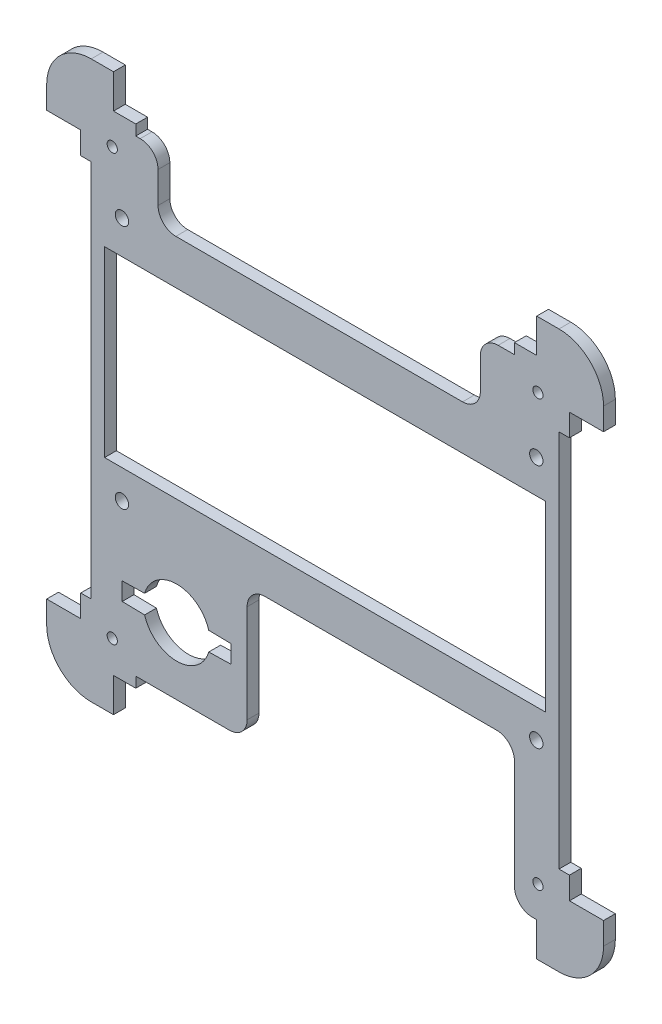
SolidWorks part; units mm, degrees
ref_plane "Alzado" through (0, 0, 0) normal (0, 0, 1) x (1, 0, 0)
ref_plane "Planta" through (0, 0, 0) normal (0, 1, 0) x (1, 0, 0)
ref_plane "Vista lateral" through (0, 0, 0) normal (1, 0, 0) x (0, 0, -1)
sketch "Croquis1" plane through (0, 0, 0) normal (0, 0, 1) x (1, 0, 0)
  line L1 (110, 125) -> (110, 117.35)
  line L2 (110, 117.35) -> (105, 117.35)
  line L6 (117.35, 105) -> (117.35, 110)
  line L7 (117.35, 110) -> (120, 110)
  line L9 (62.5, 117.35) -> (62.5, 135.4759) construction
  line L11 (110, 125) -> (115, 125)
  line L12 (125, 115) -> (125, 110)
  line L13 (125.0909, 105.0002) -> (120.0909, 105.0002) construction
  line L14 (85, 7.65) -> (40, 7.65) construction
  line L15 (117.35, 85) -> (117.35, 40) construction
  line L16 (7.65, 40) -> (7.65, 85) construction
  line L17 (40, 117.35) -> (85, 117.35) construction
  line L18 (85, 7.65) -> (40, 7.65) construction
  line L19 (117.35, 85) -> (117.35, 40) construction
  line L20 (7.65, 40) -> (7.65, 85) construction
  line L21 (40, 117.35) -> (85, 117.35) construction
  line L22 (120, 110) -> (125, 110)
  line L26 (117, 62.5) -> (135.1491, 62.5) construction
  line L27 (105, 117.35) -> (105, 105)
  line L28 (105, 105) -> (117.35, 105)
  line L29 (20, 105) -> (7.65, 105)
  line L30 (20, 117.35) -> (20, 105)
  line L32 (0, 115) -> (0, 110)
  line L33 (15, 125) -> (10, 125)
  line L36 (7.65, 110) -> (0, 110)
  line L37 (7.65, 105) -> (7.65, 110)
  line L38 (15, 117.35) -> (20, 117.35)
  line L39 (15, 125) -> (15, 117.35)
  line L42 (15, 0) -> (15, 7.65)
  line L43 (15, 7.65) -> (20, 7.65)
  line L44 (7.65, 20) -> (7.65, 15)
  line L45 (7.65, 15) -> (0, 15)
  line L48 (15, 0) -> (10, 0)
  line L49 (0, 10) -> (0, 15)
  line L51 (20, 7.65) -> (20, 20)
  line L52 (20, 20) -> (7.65, 20)
  line L53 (105, 20) -> (117.35, 20)
  line L54 (105, 7.65) -> (105, 20)
  line L56 (125, 10) -> (125, 15)
  line L57 (110, 0) -> (115, 0)
  line L60 (117.35, 15) -> (125, 15)
  line L61 (117.35, 20) -> (117.35, 15)
  line L62 (110, 7.65) -> (105, 7.65)
  line L63 (110, 0) -> (110, 7.65)
  line L65 (20, 105) -> (105, 20) construction
  line L67 (115, 10) -> (10, 10)
  line L68 (115, 10) -> (115, 115)
  line L69 (115, 115) -> (10, 115)
  line L70 (10, 10) -> (10, 115)
  line L71 (115, 10) -> (10, 115) construction
  line L72 (115, 115) -> (10, 10) construction
  arc A0 (125, 115) -> (115, 125) centre (115, 115) ccw
  arc A1 (0, 115) -> (10, 125) centre (10, 115) cw
  arc A2 (0, 10) -> (10, 0) centre (10, 10) ccw
  arc A3 (125, 10) -> (115, 0) centre (115, 10) cw
  point P22 (125, 125)
  point P53 (0, 125)
  point P68 (0, 0)
  point P83 (125, 0)
  point P84 (62.5, 62.5)
  dimension "D1" = 10
  dimension "D2" = 20
  dimension "D3" = 5
extrude "Saliente-Extruir1" add sketch "Croquis1" along normal up to surface (2.65 mm away)
sketch "Croquis2" plane through (0, 0, 2.65) normal (0, 0, 1) x (1, 0, 0)
  line L0 (62.5, 115) -> (62.5, 10) construction
  line L1 (105, 115) -> (20, 115) construction
  line L2 (105, 10) -> (20, 10) construction
  line L3 (10, 62.5) -> (115, 62.5) construction
  line L4 (10, 20) -> (10, 105) construction
  line L5 (115, 20) -> (115, 105) construction
  line L6 (105, 115) -> (20, 115) construction
  line L7 (112, 49) -> (13, 49)
  line L8 (112, 49) -> (112, 90)
  line L9 (112, 90) -> (13, 90)
  line L10 (13, 49) -> (13, 90)
  line L11 (112, 49) -> (13, 90) construction
  line L12 (112, 90) -> (13, 49) construction
  point P12 (62.5, 69.5)
  dimension "D1" = 99
  dimension "D2" = 41
  dimension "D3" = 25
extrude "Cortar-Extruir1" cut sketch "Croquis2" against normal up to surface (2.65 mm away)
sketch "Croquis3" plane through (0, 0, 2.65) normal (0, 0, 1) x (1, 0, 0)
  line L1 (63.7088, 101) -> (104.7088, 101)
  line L2 (63.7088, 101) -> (63.7088, 96)
  line L3 (63.7088, 96) -> (104.7088, 96)
  line L4 (104.7088, 101) -> (104.7088, 96)
  line L5 (105, 115) -> (20, 115) construction
  dimension "D1" = 41
  dimension "D2" = 5
  dimension "D3" = 14
extrude "Cortar-Extruir2" [suppressed] cut sketch "Croquis3" against normal blind 3
sketch "Croquis4" plane through (0, 0, 2.65) normal (0, 0, 1) x (1, 0, 0)
  line L0 (62.5, 115) -> (62.5, 103.7741) construction
  line L1 (105, 115) -> (20, 115) construction
  line L2 (10, 62.5) -> (-15.294, 62.5) construction
  line L3 (10, 20) -> (10, 105) construction
  circle A0 centre (14.7211, 110.2789) radius 1.15 construction
  circle A1 centre (14.7211, 110.2789) radius 1.15
  circle A2 centre (110.2789, 110.2789) radius 1.15
  circle A3 centre (110.2789, 14.7211) radius 1.15
  circle A4 centre (14.7211, 14.7211) radius 1.15
extrude "Cortar-Extruir4" cut sketch "Croquis4" against normal up to surface (2.65 mm away)
sketch "Croquis5" plane through (0, 0, 0) normal (0, 0, -1) x (-1, 0, 0)
  circle A2 centre (-55.5, 34.5) radius 1.5
  circle A3 centre (-99.5, 20.5) radius 1.5
extrude "Cortar-Extruir5" cut sketch "Croquis5" against normal up to surface (2.65 mm away)
sketch "Croquis6" plane through (0, 0, 0) normal (0, 0, -1) x (-1, 0, 0)
  line L0 (-16.9, 97.5) -> (-109.9, 97.5) construction
  line L1 (-109.9, 97.5) -> (-109.9, 42.5) construction
  line L2 (-109.9, 42.5) -> (-16.9, 42.5) construction
  circle A0 centre (-16.9, 42.5) radius 1.5
  circle A1 centre (-109.9, 42.5) radius 1.5
  circle A2 centre (-109.9, 97.5) radius 1.5
  circle A3 centre (-16.9, 97.5) radius 1.5
  dimension "D1" = 3
extrude "Cortar-Extruir6" cut sketch "Croquis6" against normal up to surface (2.65 mm away)
sketch "Croquis7" plane through (0, 115, 0) normal (0, 1, 0) x (1, 0, 0)
  line L0 (78.35, -1.1785) -> (97.35, -1.1785) construction
  line L1 (78.35, -1.1785) -> (97.35, -1.1785) construction
  line L2 (105, -2.65) -> (20, -2.65) construction
  line L3 (78.35, -2.65) -> (97.35, -2.65)
  line L4 (78.35, -2.65) -> (78.35, 0)
  line L5 (78.35, 0) -> (97.35, 0)
  line L6 (97.35, -2.65) -> (97.35, 0)
  line L7 (105, 0) -> (20, 0) construction
extrude "Cortar-Extruir7" cut sketch "Croquis7" against normal blind 15
sketch "Croquis8" plane through (0, 0, 2.65) normal (0, 0, 1) x (1, 0, 0)
  line L1 (77.5, 30.8656) -> (89.5, 30.8656)
  line L2 (77.5, 30.8656) -> (77.5, 18.8656)
  line L3 (77.5, 18.8656) -> (89.5, 18.8656)
  line L4 (89.5, 30.8656) -> (89.5, 18.8656)
  circle A0 centre (99.5, 20.5) radius 1.5 construction
  dimension "D1" = 22
  dimension "D2" = 12
  dimension "D3" = 12
extrude "Cortar-Extruir8" cut sketch "Croquis8" against normal up to next
sketch "Croquis9" plane through (0, 0, 2.65) normal (0, 0, 1) x (1, 0, 0)
  line L0 (109.9, 40) -> (16.9, 40) construction
  line L6 (105, 10) -> (45, 10)
  line L7 (105, 10) -> (105, 40)
  line L8 (105, 40) -> (45, 40)
  line L9 (45, 10) -> (45, 40)
  dimension "D1" = 60
extrude "Cortar-Extruir9" cut sketch "Croquis9" against normal up to next
sketch "Croquis10" plane through (0, 0, 2.65) normal (0, 0, 1) x (1, 0, 0)
  line L0 (14.4, 40) -> (43.9744, 10) construction
  line L1 (43.9744, 10) -> (14.4, 10) construction
  line L2 (43.9744, 10) -> (43.9744, 40) construction
  line L3 (43.9744, 40) -> (14.4, 40) construction
  line L4 (14.4, 10) -> (14.4, 40) construction
  line L5 (29.1872, 25) -> (47.0221, 25) construction
  line L7 (36.3868, 22.8985) -> (36.3868, 27.1015) construction
  line L10 (45, 10) -> (20, 10) construction
  line L11 (14.4, 40) -> (14.4, 42.5) construction
  line L12 (16.9, 40) -> (14.4, 40) construction
  line L13 (29.1872, 25) -> (29.1872, 31.5708) construction
  line L14 (21.9876, 27.1015) -> (16.9588, 27)
  line L15 (16.9588, 23) -> (16.9588, 27)
  line L16 (21.9876, 22.8985) -> (16.9588, 23)
  line L17 (41.4156, 23) -> (41.4156, 27)
  line L18 (36.3868, 27.1015) -> (41.4156, 27)
  line L19 (36.3868, 22.8985) -> (41.4156, 23)
  arc A0 (36.3868, 27.1015) -> (21.9876, 27.1015) centre (29.1872, 25) ccw
  arc A1 (21.9876, 22.8985) -> (36.3868, 22.8985) centre (29.1872, 25) ccw
  dimension "D1" = 15
extrude "Cortar-Extruir10" cut sketch "Croquis10" against normal up to next
sketch "Croquis11" plane through (0, 0, 0) normal (0, 0, -1) x (-1, 0, 0)
  line L0 (-10, 20) -> (-10, 105) construction
  line L1 (-78.35, 115) -> (-25, 115)
  line L2 (-78.35, 115) -> (-78.35, 100)
  line L3 (-78.35, 100) -> (-25, 100)
  line L4 (-25, 115) -> (-25, 100)
  dimension "D1" = 15
extrude "Cortar-Extruir11" cut sketch "Croquis11" against normal up to next
fillet "Redondeo1" radius 4 8 edges at (25, 100, 1.325) (97.35, 100, 1.325) (45, 10, 1.325) (105, 7.65, 1.325) (45, 40, 1.325) (105, 40, 1.325) (25, 115, 1.325) (97.35, 115, 1.325)
